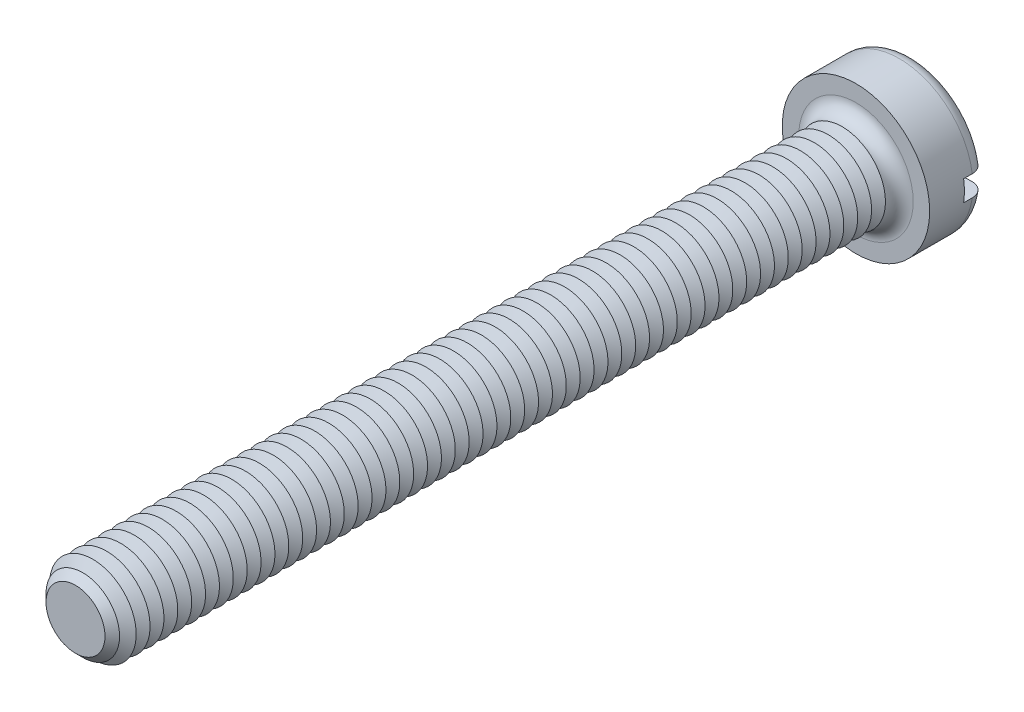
SolidWorks part; units mm, degrees
ref_plane "Front Plane" through (0, 0, 0) normal (0, 0, 1) x (1, 0, 0)
ref_plane "Top Plane" through (0, 0, 0) normal (0, 1, 0) x (1, 0, 0)
ref_plane "Right Plane" through (0, 0, 0) normal (1, 0, 0) x (0, 0, -1)
sketch "Sketch3" plane through (0, 0, 0) normal (0, 0, 1) x (1, 0, 0)
  circle A0 centre (0, 0) radius 4.25
  dimension "D1" = 8.5
extrude "Boss-Extrude2" add sketch "Sketch3" against normal blind 3.3
sketch "Sketch4" plane through (0, 0, 0) normal (0, 0, 1) x (1, 0, 0)
  circle A0 centre (0, 0) radius 2.5
  dimension "D1" = 5
extrude "Boss-Extrude3" add sketch "Sketch4" along normal blind 45
fillet "Fillet1" radius 0.8 2 edges at (4.25, 0, -3.3) (2.5, 0, 0)
chamfer "Chamfer1" distance 0.8 angle 45 1 edges at (2.5, 0, 45)
sketch "Sketch5" plane through (0, 0, 0) normal (1, 0, 0) x (0, 0, -1)
  line L0 (1.6944, 0) -> (-7.6738, 0) construction
sketch "Sketch6" plane through (0, 0, 0) normal (1, 0, 0) x (0, 0, -1)
  line L0 (-0.8, 2.5) -> (-1.2, 1.8072)
  line L1 (-1.2, 1.8072) -> (-1.6, 2.5)
  line L2 (-0.8, 2.5) -> (-44.2, 2.5) construction
  line L3 (-1.6, 2.5) -> (-0.8, 2.5)
  dimension "D1" = 0.8
revolve "Cut-Revolve1" cut sketch "Sketch6" angle 360 about L0
pattern_linear "LPattern1" count 56 spacing 0.8 along (0, 0, 1) of "Cut-Revolve1"
sketch "Sketch8" plane through (0, 0, -3.3) normal (0, 0, -1) x (-1, 0, 0)
  line L1 (4.25, -0.6) -> (-4.25, -0.6)
  line L2 (4.25, -0.6) -> (4.25, 0.6)
  line L3 (4.25, 0.6) -> (-4.25, 0.6)
  line L4 (-4.25, -0.6) -> (-4.25, 0.6)
  line L5 (4.25, -0.6) -> (-4.25, 0.6) construction
  line L6 (4.25, 0.6) -> (-4.25, -0.6) construction
  point P0 (0, 0)
  dimension "D1" = 8.5
  dimension "D2" = 1.2
extrude "Cut-Extrude1" cut sketch "Sketch8" against normal blind 1.3
